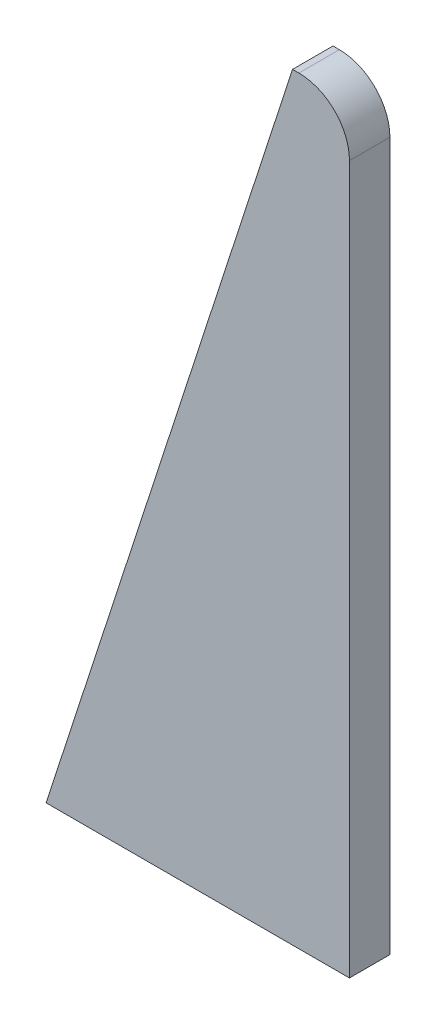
SolidWorks part; units mm, degrees
ref_plane "Przednia" through (0, 0, 0) normal (0, 0, 1) x (1, 0, 0)
ref_plane "Górna" through (0, 0, 0) normal (0, 1, 0) x (1, 0, 0)
ref_plane "Prawa" through (0, 0, 0) normal (1, 0, 0) x (0, 0, -1)
sketch "Szkic1" plane through (0, 0, 0) normal (0, 0, 1) x (1, 0, 0)
  line L0 (0, 0) -> (60, 0)
  line L1 (60, 0) -> (60, 150)
  line L2 (48.738, 150) -> (0, 0)
  line L3 (48.738, 150) -> (60, 150)
  dimension "D1" = 60
  dimension "D2" = 72
  dimension "D3" = 150
extrude "Dodanie-wyciągnięcie1" add sketch "Szkic1" along normal blind 8
hole_wizard "Otwór gwintowany M5x0.81" positions "Szkic3" profile "Szkic2" tap size "M5x0.8" standard "Ansi Metric"
sketch "Szkic3" plane through (0, 0, 0) normal (-0.9511, 0.309, 0) x (0, 0, 1)
  line L0 (4, 0) -> (4, 35)
  line L1 (8, 0) -> (0, 0) construction
  line L2 (4, 35) -> (4, 110)
  point P0 (4, 35)
  point P2 (4, 110)
  dimension "D1" = 35
  dimension "D2" = 110
sketch "Szkic2" plane through (10.8156, 33.287, 4) normal (0, 0, 1) x (-0.309, -0.9511, 0)
  line L0 (0, 0) -> (0, 15.2618)
  line L1 (0, 15.2618) -> (2.1, 14)
  line L2 (2.1, 14) -> (2.1, 0)
  line L5 (2.1, 0) -> (0, 0)
  line L10 (0, 15.2618) -> (-2.1, 14) construction
  line L11 (0, -6.35) -> (0, 107.95) construction
  dimension "Średnica wiertła gwintu" = 4.2
  dimension "Głębokość otworu gwintowanego" = 14
  dimension "Kąt wiertła" = 118
hole_wizard "Otwór gwintowany M5x0.82" positions "Szkic5" profile "Szkic4" tap size "M5x0.8" standard "Ansi Metric"
sketch "Szkic5" plane through (0, 0, 0) normal (0, -1, 0) x (-1, 0, 0)
  line L0 (0, -4) -> (-22.5, -4)
  line L1 (0, -8) -> (0, 0) construction
  line L2 (-22.5, -4) -> (-52.5, -4)
  point P0 (-22.5, -4)
  point P2 (-52.5, -4)
  dimension "D1" = 30
  dimension "D2" = 22.5
sketch "Szkic4" plane through (22.5, 0, 4) normal (1, 0, 0) x (0, 0, -1)
  line L0 (0, 0) -> (0, 15.2618)
  line L1 (0, 15.2618) -> (2.1, 14)
  line L2 (2.1, 14) -> (2.1, 0)
  line L5 (2.1, 0) -> (0, 0)
  line L10 (0, 15.2618) -> (-2.1, 14) construction
  line L11 (0, -6.35) -> (0, 107.95) construction
  dimension "Średnica wiertła gwintu" = 4.2
  dimension "Głębokość otworu gwintowanego" = 14
  dimension "Kąt wiertła" = 118
fillet "Zaokrąglenie1" [suppressed] radius 10
fillet "Zaokrąglenie2" radius 10 1 edges at (60, 150, 4)
